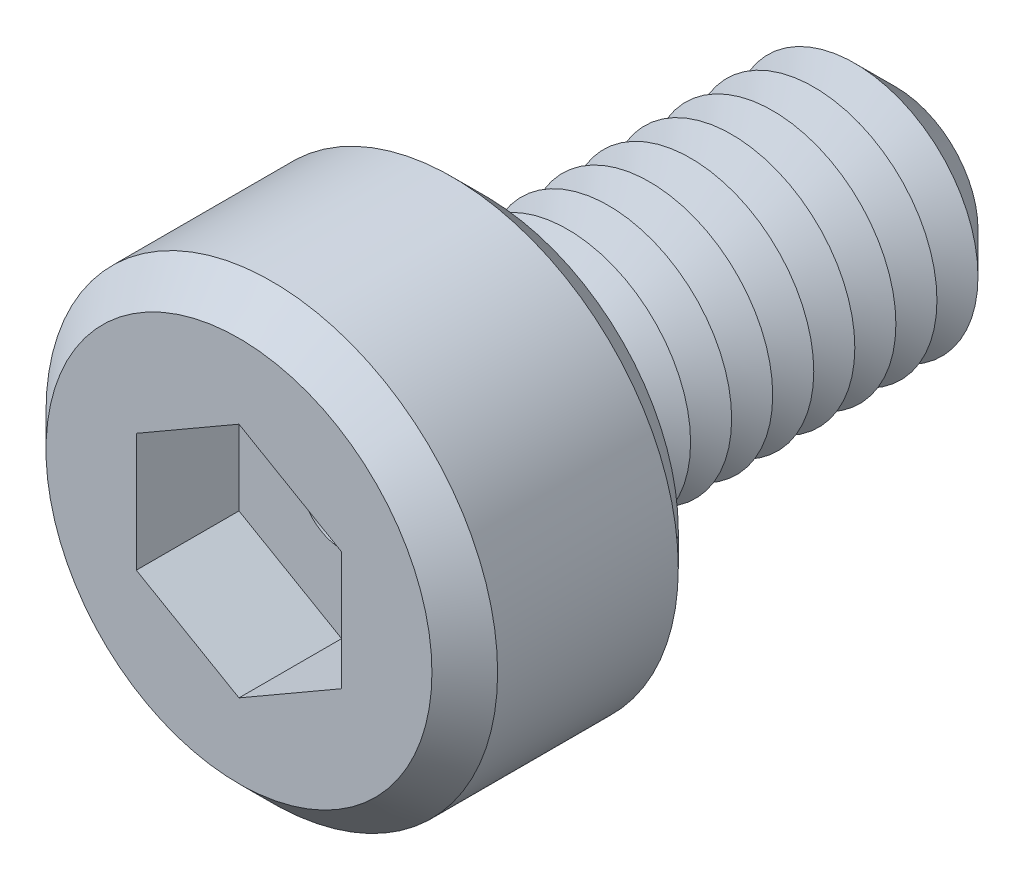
SolidWorks part; units mm, degrees
ref_plane "Front Plane" through (0, 0, 0) normal (0, 0, 1) x (1, 0, 0)
ref_plane "Top Plane" through (0, 0, 0) normal (0, 1, 0) x (1, 0, 0)
ref_plane "Right Plane" through (0, 0, 0) normal (1, 0, 0) x (0, 0, -1)
sketch "Sketch1" plane through (0, 0, 0) normal (0, 0, 1) x (1, 0, 0)
  circle A0 centre (0, 0) radius 2.75
  dimension "D1" = 5.5
extrude "Boss-Extrude1" add sketch "Sketch1" along normal blind 3
sketch "Sketch2" plane through (0, 0, 0) normal (0, 0, -1) x (-1, 0, 0)
  circle A0 centre (0, 0) radius 1.5
  dimension "D1" = 3
extrude "Boss-Extrude2" add sketch "Sketch2" along normal blind 5
chamfer "Chamfer1" distance 0.5 angle 45 1 edges at (-1.5, 0, -5)
sketch "Sketch3" plane through (0, 0, 0) normal (1, 0, 0) x (0, 0, -1)
  line L0 (-2.5121, 0) -> (4.5776, 0) construction
sketch "Sketch4" plane through (0, 0, 0) normal (1, 0, 0) x (0, 0, -1)
  line L0 (0, 1.5) -> (0.25, 1.067)
  line L1 (0.25, 1.067) -> (0.5, 1.5)
  line L2 (4.5, 1.5) -> (0, 1.5) construction
  line L3 (0.5, 1.5) -> (0, 1.5)
  dimension "D1" = 0.5
revolve "Cut-Revolve1" cut sketch "Sketch4" angle 360 about L0
pattern_linear "LPattern1" count 9 spacing 0.5 along (0, 0, -1) of "Cut-Revolve1"
sketch "Sketch5" plane through (0, 0, 3) normal (0, 0, 1) x (1, 0, 0)
  line L1 (0, 1.4434) -> (-1.25, 0.7217)
  line L2 (-1.25, 0.7217) -> (-1.25, -0.7217)
  line L3 (-1.25, -0.7217) -> (0, -1.4434)
  line L4 (0, -1.4434) -> (1.25, -0.7217)
  line L5 (1.25, -0.7217) -> (1.25, 0.7217)
  line L6 (1.25, 0.7217) -> (0, 1.4434)
  circle A0 centre (0, 0) radius 1.25 construction
  dimension "D1" = 2.5
extrude "Cut-Extrude1" cut sketch "Sketch5" against normal blind 1.25
sketch "Sketch6" plane through (0, 0, 1.75) normal (0, 0, 1) x (1, 0, 0)
  circle A0 centre (0, 0) radius 0.5
  dimension "D1" = 1
extrude "Cut-Extrude2" cut sketch "Sketch6" against normal up to surface (6.75 mm away)
chamfer "Chamfer2" distance 0.4 angle 45 2 edges at (2.75, 0, 0) (2.75, 0, 3)
